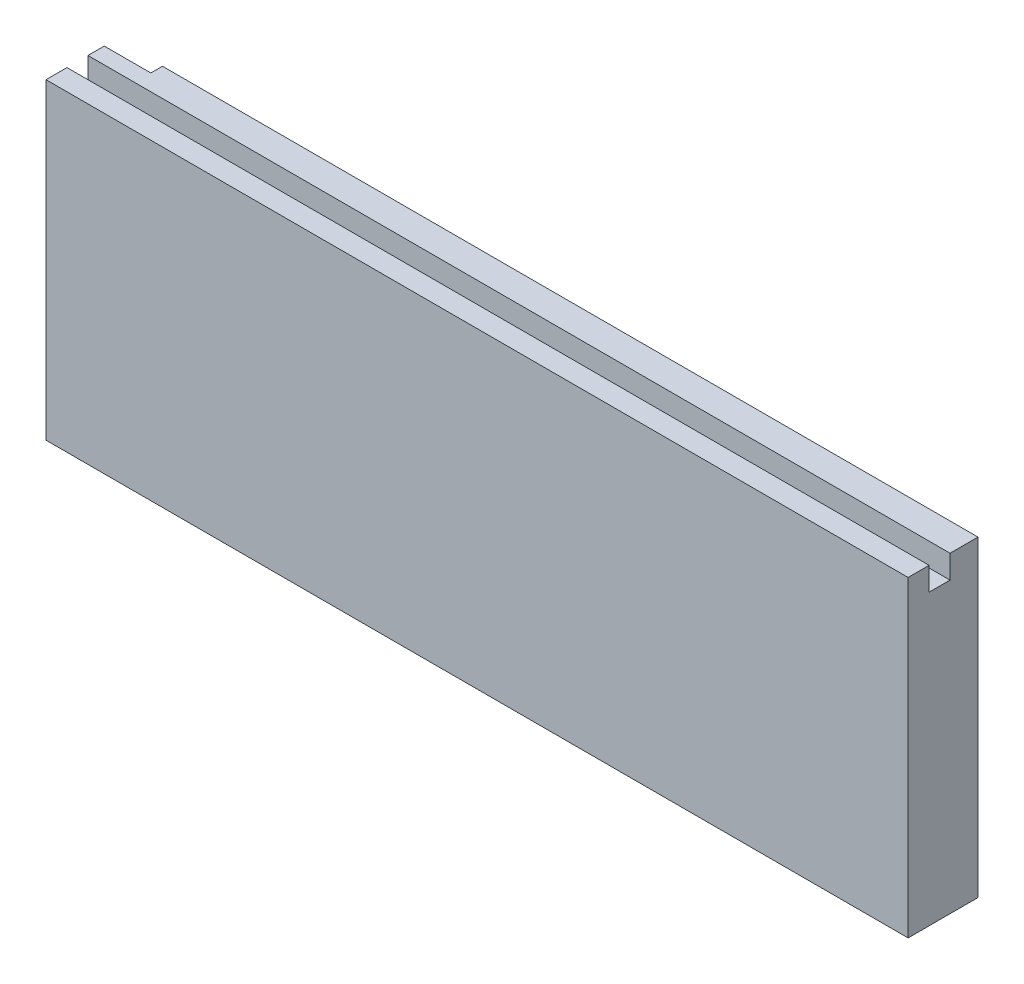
SolidWorks part; units mm, degrees
ref_plane "Plan de face" through (0, 0, 0) normal (0, 0, 1) x (1, 0, 0)
ref_plane "Plan de dessus" through (0, 0, 0) normal (0, 1, 0) x (1, 0, 0)
ref_plane "Plan de droite" through (0, 0, 0) normal (1, 0, 0) x (0, 0, -1)
sketch "Esquisse1" plane through (0, 0, 0) normal (0, 0, 1) x (1, 0, 0)
  line L1 (0, 0) -> (185, 0)
  line L2 (0, 0) -> (0, 67)
  line L3 (0, 67) -> (185, 67)
  line L4 (185, 0) -> (185, 67)
  dimension "D1" = 185
  dimension "D2" = 67
extrude "Boss.-Extru.1" add sketch "Esquisse1" along normal blind 15
sketch "Esquisse14" plane through (0, 0, 0) normal (0, 0, -1) x (-1, 0, 0)
  line L0 (-185, 67) -> (0, 67) construction
  line L1 (0, 67) -> (-10, 67)
  line L2 (0, 67) -> (0, 0)
  line L3 (0, 0) -> (-10, 0)
  line L4 (-10, 67) -> (-10, 0)
  line L5 (0, 0) -> (-185, 0) construction
  line L6 (0, 67) -> (0, 0) construction
  dimension "D1" = 10
extrude "Enlèv. mat.-Extru.10" cut sketch "Esquisse14" against normal blind 2.5
sketch "Esquisse15" plane through (185, 0, 0) normal (1, 0, 0) x (0, 0, -1)
  line L3 (-6, 67) -> (-6, 62)
  line L4 (-6, 62) -> (-10.5, 62)
  line L5 (-10.5, 62) -> (-10.5, 67)
  line L11 (-10.5, 67) -> (-6, 67)
  dimension "D3" = 4.5
  dimension "D5" = 5
extrude "Enlèv. mat.-Extru.11" cut sketch "Esquisse15" against normal through all
sketch "Esquisse16" plane through (0, 0, 6) normal (0, 0, 1) x (1, 0, 0)
  line L0 (-14.3876, 34.6124) -> (0, 49) construction
  line L1 (0, 67) -> (0, 0) construction
  line L2 (0, 62) -> (185, 62) construction
  line L3 (25, 62) -> (0, 62)
  line L4 (0, 62) -> (0, 49)
  line L5 (0, 62) -> (0, 67) construction
  spline S0 degree 3 poles (0, 49) (3.1551, 52.1551) (8.9433, 59.303) (15.9634, 62) (25, 62) knots 0 0 0 0 0.382763 1 1 1 1
  dimension "D1" = 45
  dimension "D2" = 18
  dimension "D3" = 25
extrude "Enlèv. mat.-Extru.12" cut sketch "Esquisse16" along normal up to surface (4.5 mm away)
sketch "Esquisse17" plane through (0, 0, 6) normal (0, 0, 1) x (1, 0, 0)
  line L0 (0, 65) -> (185, 65) construction
  line L1 (0, 49) -> (0, 67) construction
  line L2 (0, 65) -> (185, 65) construction
  line L3 (-7.2069, 41.7931) -> (0, 49) construction
  line L4 (0, 0) -> (0, 67) construction
  line L5 (35, 65) -> (0, 65)
  line L6 (0, 65) -> (0, 49)
  spline S0 degree 3 poles (0, 49) (9.7739, 58.7739) (19.5824, 65) (35, 65) knots 0 0 0 0 1 1 1 1
  dimension "D1" = 35
  dimension "D2" = 45
extrude "Enlèv. mat.-Extru.13" cut sketch "Esquisse17" along normal blind 4.5
